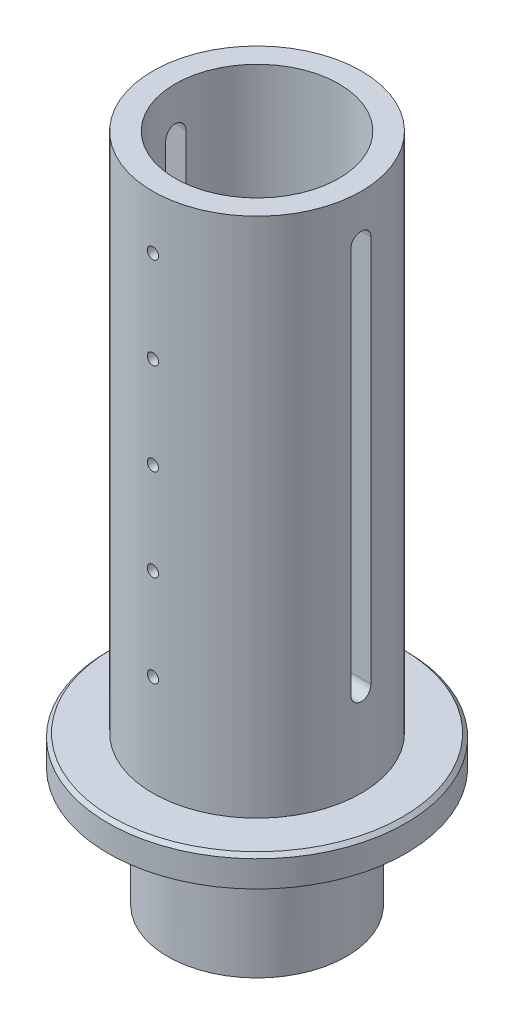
SolidWorks part; units mm, degrees
ref_plane "Front" through (0, 0, 0) normal (0, 0, 1) x (1, 0, 0)
ref_plane "Top" through (0, 0, 0) normal (0, 1, 0) x (1, 0, 0)
ref_plane "Right" through (0, 0, 0) normal (1, 0, 0) x (0, 0, -1)
sketch "Sketch1" plane through (0, 0, 0) normal (0, 0, 1) x (1, 0, 0)
  line L0 (-31.75, 127) -> (-20.574, 127)
  line L3 (-19.05, 120.65) -> (-19.05, 101.6)
  line L4 (-19.05, 101.6) -> (-17.4625, 101.6)
  line L5 (-3.1115, 133.35) -> (-3.1115, 127)
  line L6 (0, 0) -> (0, 138.1692) construction
  line L7 (-22.225, 133.35) -> (-30.988, 133.35)
  line L8 (-3.1115, 109.7216) -> (-6.8707, 109.7216)
  line L9 (-3.1115, 133.35) -> (-17.4625, 133.35)
  line L10 (-31.75, 132.588) -> (-31.75, 127)
  line L13 (-22.225, 133.35) -> (-22.225, 244.475)
  line L14 (-6.8707, 109.7216) -> (-6.8707, 107.1562)
  line L15 (-6.8707, 107.1562) -> (-17.4625, 107.1562)
  line L16 (-22.225, 244.475) -> (-17.4625, 244.475)
  line L17 (-17.4625, 133.35) -> (-17.4625, 244.475)
  line L18 (-17.4625, 107.1562) -> (-17.4625, 101.6)
  line L19 (-20.574, 127) -> (-20.574, 121.412)
  line L20 (-19.812, 120.65) -> (-19.05, 120.65)
  line L21 (33.3375, 127) -> (-33.3375, 127) construction
  line L22 (-20.574, 121.412) -> (-19.812, 120.65)
  line L23 (-3.1115, 116.0716) -> (-3.1115, 109.7216)
  line L24 (-3.1115, 127) -> (-4.6355, 127)
  line L25 (-30.988, 133.35) -> (-31.75, 132.588)
  line L26 (-3.1115, 116.0716) -> (-4.6355, 116.0716)
  line L27 (-4.6355, 127) -> (-4.6355, 116.0716)
  point P10 (-20.574, 120.65)
  point P16 (-31.75, 133.35)
  dimension "D1" = 6.35
  dimension "D2" = 25.4
  dimension "D3" = 6.223
  dimension "D4" = 41.148
  dimension "D5" = 6.35
  dimension "D6" = 63.5
  dimension "D9" = 0.762
  dimension "D7" = 38.1
  dimension "D8" = 34.925
  dimension "D10" = 5.5562
  dimension "D11" = 6.35
  dimension "D12" = 2.5654
  dimension "D13" = 3.7592
  dimension "D14" = 6.35
  dimension "D15" = 1.524
  dimension "D16" = 4.7625
  dimension "D17" = 34.925
  dimension "D20" = 0.762
  dimension "D18" = 111.125
  dimension "D19" = 142.875
  dimension "D21" = 101.6
revolve "Revolve1" add sketch "Sketch1" angle 360 about L6
hole_wizard "#4-40 Tapped Hole1" positions "Sketch3" profile "Sketch2" tap size "#4-40" standard "Ansi Inch"
sketch "Sketch3" plane through (0, 107.1562, 0) normal (0, -1, 0) x (1, 0, 0)
  point P0 (10.9985, 6.35)
  point P1 (0, 12.7)
  point P4 (-10.9985, 6.35)
  point P7 (-10.9985, -6.35)
  point P10 (0, -12.7)
  point P13 (10.9985, -6.35)
sketch "Sketch2" plane through (10.9985, 107.1562, 6.35) normal (1, 0, 0) x (0, 0, -1)
  line L0 (0, 0) -> (0, 15.2842)
  line L1 (0, 15.2842) -> (1.1303, 14.605)
  line L2 (1.1303, 14.605) -> (1.1303, 12.7)
  line L3 (1.1303, 12.7) -> (1.4224, 12.7)
  line L4 (1.4224, 12.7) -> (1.4224, 0)
  line L5 (1.4224, 0) -> (0, 0)
  line L10 (0, 15.2842) -> (-1.1303, 14.605) construction
  line L11 (0, -6.35) -> (0, 107.95) construction
  dimension "Tap Drill Dia." = 2.2606
  dimension "Tap Drill Depth" = 14.605
  dimension "Thread Major Dia." = 2.8448
  dimension "Thread Depth" = 12.7
  dimension "Drill Angle" = 118
ref_plane "Plane1" through (0, 0, 20.6375) normal (0, 0, 1) x (1, 0, 0)
hole_wizard "1/16 (0.0625) Diameter Hole1" positions "Sketch6" profile "Sketch5" hole size "1/16" standard "Ansi Inch"
sketch "Sketch6" plane through (0, 0, 20.6375) normal (0, 0, 1) x (1, 0, 0)
  line L0 (-19.812, 120.65) -> (19.812, 120.65) construction
  point P1 (0, 119.8563)
  dimension "D1" = 0.7937
sketch "Sketch5" plane through (0, 119.8563, 20.6375) normal (1, 0, 0) x (0, -1, 0)
  line L0 (0, 0) -> (0, 8.3509)
  line L1 (0, 8.3509) -> (0.7937, 7.874)
  line L2 (0.7937, 7.874) -> (0.7937, 0)
  line L5 (0.7937, 0) -> (0, 0)
  line L10 (0, 8.3509) -> (-0.7938, 7.874) construction
  line L11 (0, -6.35) -> (0, 107.95) construction
  dimension "Hole Dia." = 1.5875
  dimension "Hole Depth" = 7.874
  dimension "Drill Angle" = 118
pattern_circular "CirPattern1" count 6 over 360 about axis through (0, 0, 0) along (0, 1, 0) of "1/16 (0.0625) Diameter Hole1"
sketch "Sketch7" plane through (0, 0, 0) normal (1, 0, 0) x (0, 0, -1)
  line L0 (-31.75, 127) -> (31.75, 127) construction
  line L1 (0, 0) -> (0, 138.1692) construction
  line L3 (0, 154.8384) -> (-28.575, 154.8384) construction
  line L4 (0, 233.0704) -> (-28.575, 233.0704) construction
  line L6 (0, 174.3964) -> (-28.575, 174.3964) construction
  line L7 (0, 193.9544) -> (-28.575, 193.9544) construction
  line L8 (0, 213.5124) -> (-28.575, 213.5124) construction
  line L9 (0, 248.4374) -> (0, 223.0374) construction
  line L10 (0, 225.425) -> (0, 102.3938) construction
  line L11 (-2.1463, 234.95) -> (-2.1463, 152.4)
  line L12 (2.1463, 152.4) -> (2.1463, 234.95)
  arc A0 (-2.1463, 152.4) -> (2.1463, 152.4) centre (0, 152.4) ccw
  arc A2 (2.1463, 234.95) -> (-2.1463, 234.95) centre (0, 234.95) ccw
  dimension "D1" = 4.2926
  dimension "D2" = 25.4
  dimension "D3" = 107.95
  dimension "D4" = 28.575
  dimension "D8" = 78.232
  dimension "D9" = 19.558
  dimension "D5" = 19.558
  dimension "D6" = 19.558
  dimension "D7" = 19.558
extrude "Cut-Extrude1" cut sketch "Sketch7" against normal through all and the other way through all
sketch "Sketch8" plane through (0, 0, 0) normal (0, 0, 1) x (1, 0, 0)
  circle A0 centre (0, 233.0704) radius 1.1938
  circle A1 centre (0, 213.5124) radius 1.1938
  circle A2 centre (0, 193.9544) radius 1.1938
  circle A3 centre (0, 174.3964) radius 1.1938
  circle A4 centre (0, 154.8384) radius 1.1938
  dimension "D1" = 2.3876
extrude "Cut-Extrude2" cut sketch "Sketch8" along normal through all
